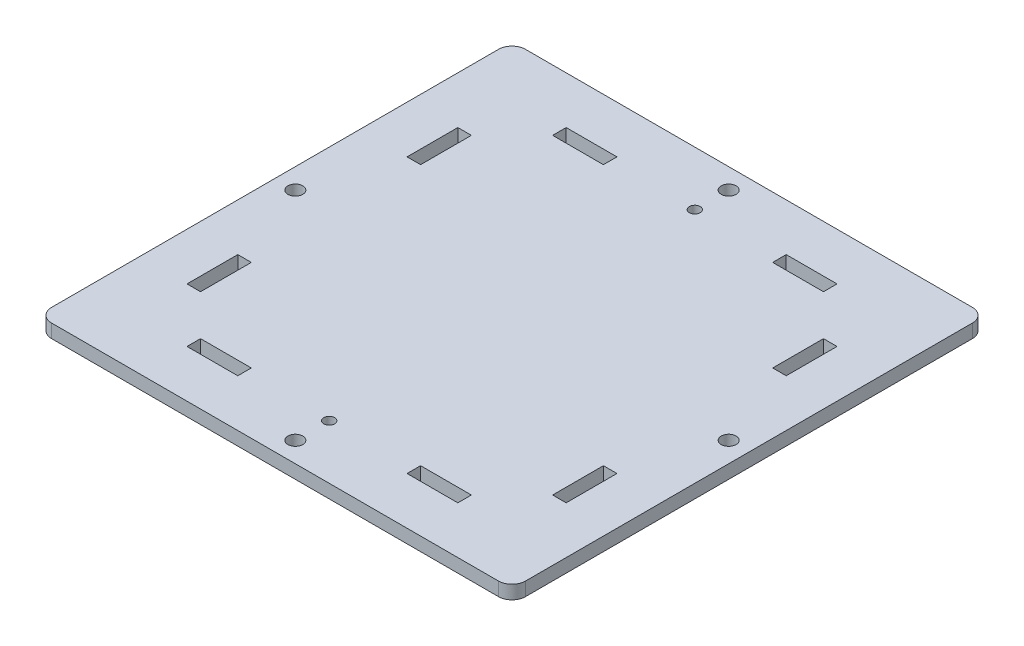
SolidWorks part; units mm, degrees
ref_plane "Ebene vorne" through (0, 0, 0) normal (0, 0, 1) x (1, 0, 0)
ref_plane "Ebene oben" through (0, 0, 0) normal (0, 1, 0) x (1, 0, 0)
ref_plane "Ebene rechts" through (0, 0, 0) normal (1, 0, 0) x (0, 0, -1)
sketch "Skizze2" plane through (0, 0, 0) normal (0, -1, 0) x (1, 0, 0)
  line L0 (0, 63.5818) -> (0, -70.6997) construction
  line L1 (-66, 70) -> (66, 70)
  line L2 (-70, 66) -> (-70, -66)
  line L3 (-66, -70) -> (66, -70)
  line L4 (70, 66) -> (70, -66)
  line L5 (-63.2683, 0) -> (64.2442, 0) construction
  line L6 (25, 56) -> (25, 52)
  line L7 (-40, 56) -> (-25, 56)
  line L8 (-40, 56) -> (-40, 52)
  line L9 (-40, 52) -> (-25, 52)
  line L10 (-25, 56) -> (-25, 52)
  line L11 (40, 52) -> (25, 52)
  line L12 (40, 56) -> (40, 52)
  line L13 (40, 56) -> (25, 56)
  line L14 (56, -25) -> (52, -25)
  line L15 (56, 40) -> (56, 25)
  line L16 (56, 40) -> (52, 40)
  line L17 (52, 40) -> (52, 25)
  line L18 (56, 25) -> (52, 25)
  line L19 (52, -40) -> (52, -25)
  line L20 (56, -40) -> (52, -40)
  line L21 (56, -40) -> (56, -25)
  line L22 (-25, -56) -> (-25, -52)
  line L23 (40, -56) -> (25, -56)
  line L24 (40, -56) -> (40, -52)
  line L25 (40, -52) -> (25, -52)
  line L26 (25, -56) -> (25, -52)
  line L27 (-40, -52) -> (-25, -52)
  line L28 (-40, -56) -> (-40, -52)
  line L29 (-40, -56) -> (-25, -56)
  line L30 (-56, 25) -> (-52, 25)
  line L31 (-56, -40) -> (-56, -25)
  line L32 (-56, -40) -> (-52, -40)
  line L33 (-52, -40) -> (-52, -25)
  line L34 (-56, -25) -> (-52, -25)
  line L35 (-52, 40) -> (-52, 25)
  line L36 (-56, 40) -> (-52, 40)
  line L37 (-56, 40) -> (-56, 25)
  line L38 (-25, 54) -> (25, 54) construction
  circle A0 centre (0, 54) radius 1.6
  circle A1 centre (0, -54) radius 1.6
  arc A3 (-70, -66) -> (-66, -70) centre (-66, -66) ccw
  arc A4 (70, -66) -> (66, -70) centre (66, -66) cw
  arc A5 (66, 70) -> (70, 66) centre (66, 66) cw
  arc A6 (-66, 70) -> (-70, 66) centre (-66, 66) ccw
  circle A9 centre (0, 64) radius 2.2
  circle A10 centre (64, 0) radius 2.2
  circle A11 centre (0, -64) radius 2.2
  circle A12 centre (-64, 0) radius 2.2
  point P25 (-70, -70)
  point P50 (0, 0)
  point P55 (70, 70)
  point P58 (-70, 70)
  point P74 (0, 0)
  dimension "D3" = 3.2
  dimension "D11" = 4
  dimension "D13" = 4.4
  dimension "D15" = 4
  dimension "D1" = 140
  dimension "D2" = 140
  dimension "D6" = 4
  dimension "D7" = 14
  dimension "D8" = 15
  dimension "D9" = 25
  dimension "D14" = 6
  dimension "D10" = 4
extrude "Aufsatz-Linear austragen1" add sketch "Skizze2" along normal blind 4
